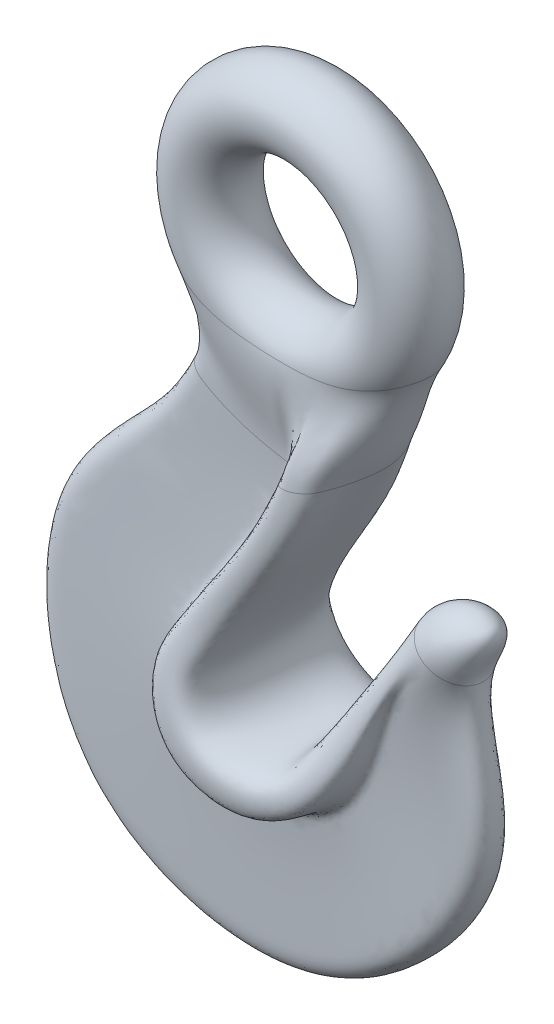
SolidWorks part; units mm, degrees
ref_plane "Front Plane" through (0, 0, 0) normal (0, 0, 1) x (1, 0, 0)
ref_plane "Top Plane" through (0, 0, 0) normal (0, 1, 0) x (1, 0, 0)
ref_plane "Right Plane" through (0, 0, 0) normal (1, 0, 0) x (0, 0, -1)
sketch "Hook Picture" plane through (0, 0, 0) normal (0, 0, 1) x (1, 0, 0)
  circle A0 centre (0, 0) radius 15.875
  dimension "D1" = 31.75
sketch "Hook Contours" plane through (0.053, -0.0979, 0) normal (0, 0, -1) x (-1, 0, 0)
  spline S0 degree 3 poles (-37.0649, -11.0348) (-33.406, -17.3469) (-23.4322, -34.5529) (-10.3758, -57.4401) (1.4723, -77.7839) (7.7336, -88.8425) (10.526, -96.4469) (9.0596, -102.7432) (3.227, -107.6041) (-5.9826, -108.2355) (-11.6869, -101.0235) (-19.561, -88.6039) (-31.2208, -64.4016) (-44.5434, -45.0515) (-52.6215, -33.3186) knots 0 0 0 0 0.105771 0.288319 0.382351 0.446424 0.473781 0.496704 0.535324 0.576409 0.614493 0.659301 0.793419 1 1 1 1
  spline S1 degree 3 poles (6.79, 9.0817) (17.9755, -12.7007) (24.4514, -50.3784) (68.0162, -79.5197) (61.5403, -150.4596) (-11.1658, -170.7703) (-69.7428, -101.3021) (-25.0006, -71.572) (-68.271, -43.0194) knots 0 0 0 0 0.187665 0.310404 0.449466 0.570855 0.727344 1 1 1 1
ref_plane "First Profile Plane" through (26.1585, -30.076, 0) normal (-0.4993, -0.8664, 0) x (-0.8664, 0.4993, 0)
ref_plane "Second Profile Plane" through (7.33, -62.8197, 0) normal (-0.5006, -0.8657, 0) x (-0.8657, 0.5006, 0)
ref_plane "Third Profile Plane" through (-2.4042, -79.6657, 0) normal (-0.497, -0.8677, 0) x (-0.8677, 0.497, 0)
ref_plane "Fourth Profile Plane" through (-8.5007, -91.4382, 0) normal (-0.389, -0.9212, 0) x (-0.9212, 0.389, 0)
ref_plane "Fifth Profile Plane" through (-2.9145, -106.7992, 0) normal (0.9278, -0.3731, 0) x (0, 0, -1)
ref_plane "Sixth Profile Plane" through (11.2604, -101.529, 0) normal (0.584, 0.8117, 0) x (0.8117, -0.584, 0)
ref_plane "Seventh Profile Plane" through (29.5499, -69.3647, 0) normal (0.4874, 0.8732, 0) x (0.8732, -0.4874, 0)
sketch "First Profile" plane through (26.1585, -30.076, 0) normal (-0.4993, -0.8664, 0) x (-0.8664, 0.4993, 0)
  ellipse E0 centre (23.0895, 0) end of major axis (46.179, 0) minor radius 12.7
  dimension "D1" = 25.4
sketch "Second Profile" plane through (7.8492, -63.1199, -0.005) normal (-0.5006, -0.8657, 0) x (0, 0, -1)
  line L4 (-0.005, -0.5998) -> (-0.005, -41.66) construction
  spline S0 degree 3 poles (-0.005, -0.5998) (2.275, -0.5998) (6.2945, -0.5929) (13.5118, -1.5507) (15.3782, -4.4442) (14.984, -9.4172) (10.2878, -10.3403) (6.1023, -10.655) (5.3332, -20.9723) (5.415, -29.1702) (5.1328, -39.0618) (2.9458, -41.4318) (1.3016, -41.66) (-0.005, -41.66) knots 0 0 0 0 0.105066 0.207759 0.289001 0.348754 0.392733 0.478371 0.507138 0.854035 0.919937 0.944739 1 1 1 1 construction
  spline S1 degree 3 poles (-0.005, -0.5998) (-2.2849, -0.5998) (-6.3044, -0.5929) (-13.5217, -1.5507) (-15.3882, -4.4442) (-14.9939, -9.4172) (-10.2978, -10.3403) (-6.1122, -10.655) (-5.3432, -20.9723) (-5.425, -29.1702) (-5.1427, -39.0618) (-2.9558, -41.4318) (-1.3116, -41.66) (-0.005, -41.66) knots 0 0 0 0 0.105066 0.207759 0.289001 0.348754 0.392733 0.478371 0.507138 0.854035 0.919937 0.944739 1 1 1 1 construction
  spline S2 degree 3 poles (-0.005, -0.5998) (-2.2849, -0.5998) (-6.3044, -0.5929) (-13.5217, -1.5507) (-15.3882, -4.4442) (-14.9939, -9.4172) (-10.2978, -10.3403) (-6.1122, -10.655) (-5.3432, -20.9723) (-5.425, -29.1702) (-5.1427, -39.0618) (-2.9558, -41.4318) (-1.3116, -41.66) (-0.005, -41.66) (1.3016, -41.66) (2.9458, -41.4318) (5.1328, -39.0618) (5.415, -29.1702) (5.3332, -20.9723) (6.1023, -10.655) (10.2878, -10.3403) (14.984, -9.4172) (15.3782, -4.4442) (13.5118, -1.5507) (6.2945, -0.5929) (2.275, -0.5998) (-0.005, -0.5998) (-2.2849, -0.5998) (-6.3044, -0.5929) knots -0.052533 0 0 0 0.052533 0.10388 0.144501 0.174377 0.196367 0.239185 0.253569 0.427018 0.459969 0.47237 0.5 0.5 0.5 0.52763 0.540031 0.572982 0.746431 0.760815 0.803633 0.825623 0.855499 0.89612 0.947467 1 1 1 1.052533 1.10388 1.144501 only from (-0.005, -0.5998) to (-0.005, -0.5998)
sketch "Third Profile" plane through (-1.8837, -79.9638, -0.005) normal (-0.497, -0.8677, 0) x (0, 0, -1)
  line L4 (-0.005, -0.5998) -> (-0.005, -43.6903) construction
  spline S0 degree 3 poles (-0.005, -0.5998) (2.3878, -0.5998) (6.606, -0.5926) (14.1801, -1.5977) (16.1389, -4.6342) (15.7252, -9.8532) (10.7968, -10.8219) (6.4043, -11.1522) (5.5972, -21.9796) (5.683, -30.5829) (5.3868, -40.9636) (3.0917, -43.4508) (1.3662, -43.6903) (-0.005, -43.6903) knots 0 0 0 0 0.105066 0.207759 0.289001 0.348754 0.392733 0.478371 0.507138 0.854035 0.919937 0.944739 1 1 1 1 construction
  spline S1 degree 3 poles (-0.005, -0.5998) (-2.3977, -0.5998) (-6.6159, -0.5926) (-14.19, -1.5977) (-16.1488, -4.6342) (-15.7351, -9.8532) (-10.8067, -10.8219) (-6.4142, -11.1522) (-5.6071, -21.9796) (-5.693, -30.5829) (-5.3967, -40.9636) (-3.1017, -43.4508) (-1.3762, -43.6903) (-0.005, -43.6903) knots 0 0 0 0 0.105066 0.207759 0.289001 0.348754 0.392733 0.478371 0.507138 0.854035 0.919937 0.944739 1 1 1 1 construction
  spline S2 degree 3 poles (-0.005, -0.5998) (-2.3977, -0.5998) (-6.6159, -0.5926) (-14.19, -1.5977) (-16.1488, -4.6342) (-15.7351, -9.8532) (-10.8067, -10.8219) (-6.4142, -11.1522) (-5.6071, -21.9796) (-5.693, -30.5829) (-5.3967, -40.9636) (-3.1017, -43.4508) (-1.3762, -43.6903) (-0.005, -43.6903) (1.3662, -43.6903) (3.0917, -43.4508) (5.3868, -40.9636) (5.683, -30.5829) (5.5972, -21.9796) (6.4043, -11.1522) (10.7968, -10.8219) (15.7252, -9.8532) (16.1389, -4.6342) (14.1801, -1.5977) (6.606, -0.5926) (2.3878, -0.5998) (-0.005, -0.5998) (-2.3977, -0.5998) (-6.6159, -0.5926) knots -0.052533 0 0 0 0.052533 0.10388 0.144501 0.174377 0.196367 0.239185 0.253569 0.427018 0.459969 0.47237 0.5 0.5 0.5 0.52763 0.540031 0.572982 0.746431 0.760815 0.803633 0.825623 0.855499 0.89612 0.947467 1 1 1 1.052533 1.10388 1.144501 only from (-0.005, -0.5998) to (-0.005, -0.5998)
sketch "Fourth Profile" plane through (-7.9481, -91.6716, -0.005) normal (-0.389, -0.9212, 0) x (0, 0, -1)
  line L4 (-0.005, -0.5998) -> (-0.005, -48.7005) construction
  spline S0 degree 3 poles (-0.005, -0.5998) (2.666, -0.5998) (7.3747, -0.5917) (15.8294, -1.7137) (18.0159, -5.1033) (17.5541, -10.9291) (12.0527, -12.0104) (7.1495, -12.3791) (6.2486, -24.4655) (6.3444, -34.069) (6.0137, -45.6568) (3.4518, -48.4332) (1.5257, -48.7005) (-0.005, -48.7005) knots 0 0 0 0 0.105066 0.207759 0.289001 0.348754 0.392733 0.478371 0.507138 0.854035 0.919937 0.944739 1 1 1 1 construction
  spline S1 degree 3 poles (-0.005, -0.5998) (-2.6759, -0.5998) (-7.3846, -0.5917) (-15.8394, -1.7137) (-18.0259, -5.1033) (-17.5641, -10.9291) (-12.0626, -12.0104) (-7.1594, -12.3791) (-6.2585, -24.4655) (-6.3543, -34.069) (-6.0236, -45.6568) (-3.4617, -48.4332) (-1.5356, -48.7005) (-0.005, -48.7005) knots 0 0 0 0 0.105066 0.207759 0.289001 0.348754 0.392733 0.478371 0.507138 0.854035 0.919937 0.944739 1 1 1 1 construction
  spline S2 degree 3 poles (-0.005, -0.5998) (-2.6759, -0.5998) (-7.3846, -0.5917) (-15.8394, -1.7137) (-18.0259, -5.1033) (-17.5641, -10.9291) (-12.0626, -12.0104) (-7.1594, -12.3791) (-6.2585, -24.4655) (-6.3543, -34.069) (-6.0236, -45.6568) (-3.4617, -48.4332) (-1.5356, -48.7005) (-0.005, -48.7005) (1.5257, -48.7005) (3.4518, -48.4332) (6.0137, -45.6568) (6.3444, -34.069) (6.2486, -24.4655) (7.1495, -12.3791) (12.0527, -12.0104) (17.5541, -10.9291) (18.0159, -5.1033) (15.8294, -1.7137) (7.3747, -0.5917) (2.666, -0.5998) (-0.005, -0.5998) (-2.6759, -0.5998) (-7.3846, -0.5917) knots -0.052533 0 0 0 0.052533 0.10388 0.144501 0.174377 0.196367 0.239185 0.253569 0.427018 0.459969 0.47237 0.5 0.5 0.5 0.52763 0.540031 0.572982 0.746431 0.760815 0.803633 0.825623 0.855499 0.89612 0.947467 1 1 1 1.052533 1.10388 1.144501 only from (-0.005, -0.5998) to (-0.005, -0.5998)
sketch "Fifth Profile" plane through (-2.9126, -106.7946, 0.5998) normal (0.9278, -0.3731, 0) x (0.3731, 0.9278, 0)
  line L4 (-0.005, -0.5998) -> (-56.0362, -0.5998) construction
  spline S0 degree 3 poles (-0.005, -0.5998) (-0.005, -3.7111) (0.0044, -9.1961) (-1.3025, -19.0449) (-5.251, -21.5918) (-12.0373, -21.0539) (-13.2969, -14.6454) (-13.7264, -8.9338) (-27.8055, -7.8844) (-38.9924, -7.996) (-52.4906, -7.6108) (-55.7248, -4.6265) (-56.0362, -2.3828) (-56.0362, -0.5998) knots 0 0 0 0 0.105066 0.207759 0.289001 0.348754 0.392733 0.478371 0.507138 0.854035 0.919937 0.944739 1 1 1 1 construction
  spline S1 degree 3 poles (-0.005, -0.5998) (-0.005, 2.5115) (0.0044, 7.9966) (-1.3025, 17.8453) (-5.251, 20.3923) (-12.0373, 19.8543) (-13.2969, 13.4459) (-13.7264, 7.7342) (-27.8055, 6.6848) (-38.9924, 6.7964) (-52.4906, 6.4112) (-55.7248, 3.4269) (-56.0362, 1.1832) (-56.0362, -0.5998) knots 0 0 0 0 0.105066 0.207759 0.289001 0.348754 0.392733 0.478371 0.507138 0.854035 0.919937 0.944739 1 1 1 1 construction
  spline S2 degree 3 poles (-0.005, -0.5998) (-0.005, 2.5115) (0.0044, 7.9966) (-1.3025, 17.8453) (-5.251, 20.3923) (-12.0373, 19.8543) (-13.2969, 13.4459) (-13.7264, 7.7342) (-27.8055, 6.6848) (-38.9924, 6.7964) (-52.4906, 6.4112) (-55.7248, 3.4269) (-56.0362, 1.1832) (-56.0362, -0.5998) (-56.0362, -2.3828) (-55.7248, -4.6265) (-52.4906, -7.6108) (-38.9924, -7.996) (-27.8055, -7.8844) (-13.7264, -8.9338) (-13.2969, -14.6454) (-12.0373, -21.0539) (-5.251, -21.5918) (-1.3025, -19.0449) (0.0044, -9.1961) (-0.005, -3.7111) (-0.005, -0.5998) (-0.005, 2.5115) (0.0044, 7.9966) knots -0.052533 0 0 0 0.052533 0.10388 0.144501 0.174377 0.196367 0.239185 0.253569 0.427018 0.459969 0.47237 0.5 0.5 0.5 0.52763 0.540031 0.572982 0.746431 0.760815 0.803633 0.825623 0.855499 0.89612 0.947467 1 1 1 1.052533 1.10388 1.144501 only from (-0.005, -0.5998) to (-0.005, -0.5998)
sketch "Sixth Profile" plane through (10.7735, -101.1787, -0.005) normal (0.584, 0.8117, 0) x (0, 0, -1)
  line L4 (-0.005, -0.5998) -> (-0.005, -40.3248) construction
  spline S0 degree 3 poles (-0.005, -0.5998) (2.2009, -0.5998) (6.0897, -0.5931) (13.0722, -1.5197) (14.878, -4.3191) (14.4966, -9.1305) (9.9531, -10.0235) (5.9037, -10.328) (5.1597, -20.3098) (5.2388, -28.2411) (4.9657, -37.8111) (2.8499, -40.104) (1.2592, -40.3248) (-0.005, -40.3248) knots 0 0 0 0 0.105066 0.207759 0.289001 0.348754 0.392733 0.478371 0.507138 0.854035 0.919937 0.944739 1 1 1 1 construction
  spline S1 degree 3 poles (-0.005, -0.5998) (-2.2108, -0.5998) (-6.0996, -0.5931) (-13.0822, -1.5197) (-14.8879, -4.3191) (-14.5065, -9.1305) (-9.9631, -10.0235) (-5.9136, -10.328) (-5.1696, -20.3098) (-5.2487, -28.2411) (-4.9756, -37.8111) (-2.8598, -40.104) (-1.2691, -40.3248) (-0.005, -40.3248) knots 0 0 0 0 0.105066 0.207759 0.289001 0.348754 0.392733 0.478371 0.507138 0.854035 0.919937 0.944739 1 1 1 1 construction
  spline S2 degree 3 poles (-0.005, -0.5998) (-2.2108, -0.5998) (-6.0996, -0.5931) (-13.0822, -1.5197) (-14.8879, -4.3191) (-14.5065, -9.1305) (-9.9631, -10.0235) (-5.9136, -10.328) (-5.1696, -20.3098) (-5.2487, -28.2411) (-4.9756, -37.8111) (-2.8598, -40.104) (-1.2691, -40.3248) (-0.005, -40.3248) (1.2592, -40.3248) (2.8499, -40.104) (4.9657, -37.8111) (5.2388, -28.2411) (5.1597, -20.3098) (5.9037, -10.328) (9.9531, -10.0235) (14.4966, -9.1305) (14.878, -4.3191) (13.0722, -1.5197) (6.0897, -0.5931) (2.2009, -0.5998) (-0.005, -0.5998) (-2.2108, -0.5998) (-6.0996, -0.5931) knots -0.052533 0 0 0 0.052533 0.10388 0.144501 0.174377 0.196367 0.239185 0.253569 0.427018 0.459969 0.47237 0.5 0.5 0.5 0.52763 0.540031 0.572982 0.746431 0.760815 0.803633 0.825623 0.855499 0.89612 0.947467 1 1 1 1.052533 1.10388 1.144501 only from (-0.005, -0.5998) to (-0.005, -0.5998)
sketch "Seventh Profile" plane through (29.5499, -69.3647, 0) normal (0.4874, 0.8732, 0) x (0.8732, -0.4874, 0)
  ellipse E0 centre (8.0557, 0) end of major axis (16.1114, 0) minor radius 7.62
  dimension "D1" = 15.24
other "Hook Body"
sketch "Sketch1" plane through (0, 0, 0) normal (1, 0, 0) x (0, 0, -1)
  line L0 (-14.7758, 0) -> (14.7758, 0) construction
  circle A0 centre (0, 25.4) radius 9.525
  dimension "D1" = 19.05
  dimension "D2" = 31.75
revolve "Loop" add sketch "Sketch1" angle 360 about L0
sketch "Sketch2" plane through (0, 0, 0) normal (0, 0, 1) x (1, 0, 0)
  circle A0 centre (0, 0) radius 46.99
  dimension "D1" = 93.98
extrude "Cut-Extrude1" cut sketch "Sketch2" against normal through all both and the other way through all
sketch "Sketch3" plane through (0, 0, 0) normal (0, 0, 1) x (1, 0, 0)
  circle A0 centre (1.3462, 43.815) radius 67.31
  dimension "D1" = 134.62
  dimension "D2" = 1.3462
  dimension "D3" = 43.815
extrude "Cut-Extrude2" cut sketch "Sketch3" against normal through all both and the other way through all flip side to cut
other "Transition"
ref_plane "Plane1" through (-16.311, -29.2176, 0) normal (0.4874, 0.8732, 0) x (0.8732, -0.4874, 0)
sketch "Sketch4" plane through (-16.311, -29.2176, 0) normal (0.4874, 0.8732, 0) x (0.8732, -0.4874, 0)
  point P0 (71.12, 0)
  dimension "D1" = 71.12
other "Tip"
